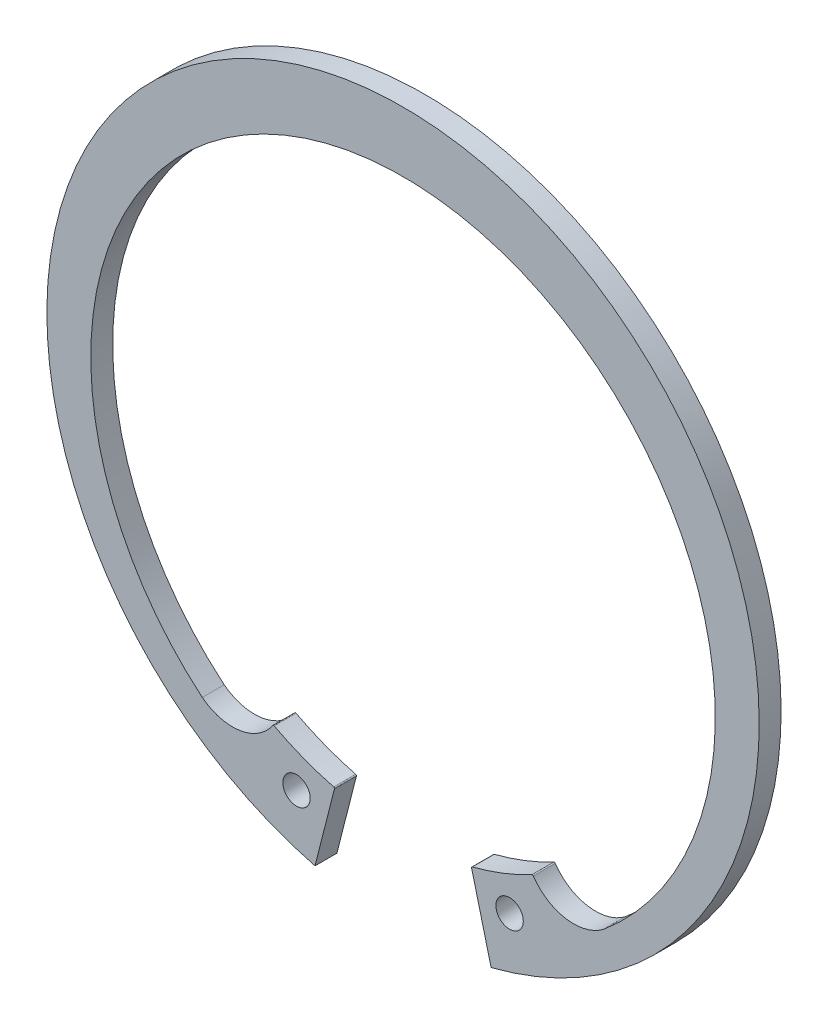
SolidWorks part; units mm, degrees
ref_plane "Plane1" through (0, 0, 0) normal (0, 0, 1) x (1, 0, 0)
ref_plane "Plane2" through (0, 0, 0) normal (0, 1, 0) x (1, 0, 0)
ref_plane "Plane3" through (0, 0, 0) normal (1, 0, 0) x (0, 0, -1)
sketch "Clipboard" plane through (0, 0, 0) normal (0, 0, 1) x (1, 0, 0)
  line L0 (0, 0) -> (5.5, 0)
  line L1 (0, 0) -> (0, 2.75)
  line L2 (0, 0) -> (0, -7.3)
  circle A0 centre (0, 0) radius 1.25
  circle A1 centre (0, 0) radius 31
  dimension "HoleDia" = 2.5
  dimension "BoreDia" = 62
  dimension "LargeSection" = 5.5
  dimension "SmallSection" = 2.75
  dimension "LugSection" = 7.3
sketch "BodySke" plane through (0, 0, 0) normal (0, 0, 1) x (1, 0, 0)
  line L0 (-1.5431, 0) -> (1.5431, 0) construction
  line L1 (0, 0) -> (0, 27) construction
  line L2 (8.0368, -31.4906) -> (6.9116, -27.0819)
  line L3 (-8.0368, -31.4906) -> (-6.9116, -27.0819)
  line L4 (0, 0) -> (17.2586, -27.5389) construction
  line L5 (0, 0) -> (-17.2586, -27.5389) construction
  line L6 (-9.4124, -25.1536) -> (-10.0307, -27.576) construction
  line L7 (9.5359, -25.6375) -> (9.9072, -27.0921) construction
  arc A0 (-6.9116, -27.0819) -> (-11.9896, -24.5575) centre (-9.7215, -26.3648) ccw
  arc A1 (11.9896, -24.5575) -> (6.9116, -27.0819) centre (9.7215, -26.3648) ccw
  arc A2 (15.7982, -25.2087) -> (-15.7982, -25.2087) centre (0, -1.4946) ccw construction
  arc A3 (8.0368, -31.4906) -> (-8.0368, -31.4906) centre (0, 0) ccw
  circle A4 centre (9.7215, -26.3648) radius 1.25
  circle A5 centre (-9.7215, -26.3648) radius 1.25
  circle A6 centre (9.7215, -26.3648) radius 2.9 construction
  arc A7 (15.873, -25.1587) -> (-15.873, -25.1587) centre (0, -1.4946) ccw
  arc A8 (-9.7215, -26.3648) -> (9.7215, -26.3648) centre (0, 0) ccw construction
  arc A9 (-15.873, -25.1587) -> (-11.9896, -24.5575) centre (-14.2576, -22.7503) ccw
  arc A10 (11.9896, -24.5575) -> (15.873, -25.1587) centre (14.2576, -22.7503) ccw
  dimension "GrooveDia" = 65
  dimension "TipRad" = 2.9
  dimension "HoleOffsetRad" = 28.1
  dimension "HoleDia" = 2.5
  dimension "FilletRad" = 2.9
  dimension "LargeRad" = 27
  dimension "SmallRad" = 29.75
  dimension "SmallAngle" = 64.151
  dimension "GapAngle" = 28.634
extrude "Body" add sketch "BodySke" against normal blind 2
sketch "ModLugSke" plane through (0, 0, 0) normal (0, 0, 1) x (1, 0, 0)
  line L0 (8.0368, -31.4906) -> (6.2563, -24.5141)
  line L1 (-8.0368, -31.4906) -> (-6.2563, -24.5141)
  line L2 (15.5667, -19.8171) -> (20.0761, -25.5578) construction
  line L3 (-15.5667, -19.8171) -> (-20.0761, -25.5578) construction
  line L4 (-8.0368, -31.4906) -> (-6.9116, -27.0819) construction
  line L5 (6.9116, -27.0819) -> (8.0368, -31.4906) construction
  line L6 (0, 0) -> (0, -18.0732) construction
  line L7 (18.317, -23.3183) -> (20.0761, -25.5578)
  line L8 (-20.0761, -25.5578) -> (-18.317, -23.3183)
  arc A0 (8.0368, -31.4906) -> (20.0761, -25.5578) centre (0, 0) ccw
  arc A1 (-11.7565, -22.2896) -> (-6.3281, -24.3925) centre (0, 0) ccw
  arc A2 (8.0368, -31.4906) -> (-8.0368, -31.4906) centre (0, 0) ccw construction
  arc A3 (11.9896, -24.5575) -> (6.9116, -27.0819) centre (9.7215, -26.3648) ccw construction
  arc A4 (-11.7565, -22.2896) -> (-11.8858, -22.3218) centre (-11.8031, -22.378) ccw
  arc A5 (-18.317, -23.3183) -> (-11.8858, -22.3218) centre (-15.5667, -19.8171) ccw
  arc A6 (15.873, -25.1587) -> (-15.873, -25.1587) centre (0, -1.4946) ccw construction
  arc A7 (11.8858, -22.3218) -> (18.317, -23.3183) centre (15.5667, -19.8171) ccw
  arc A8 (6.3281, -24.3925) -> (11.7565, -22.2896) centre (0, 0) ccw
  arc A9 (-20.0761, -25.5578) -> (-8.0368, -31.4906) centre (0, 0) ccw
  circle A10 centre (-9.7215, -26.3648) radius 1.25
  circle A11 centre (-9.7215, -26.3648) radius 1.25 construction
  circle A12 centre (9.7215, -26.3648) radius 1.25
  circle A13 centre (9.7215, -26.3648) radius 1.25 construction
  arc A14 (-6.3281, -24.3925) -> (-6.2563, -24.5141) centre (-6.3532, -24.4893) cw
  arc A15 (6.3281, -24.3925) -> (6.2563, -24.5141) centre (6.3532, -24.4893) ccw
  arc A16 (11.7565, -22.2896) -> (11.8858, -22.3218) centre (11.8031, -22.378) cw
  point P43 (6.2316, -24.4174)
  dimension "D1" = 0.1
  dimension "LugAng" = 55.618
extrude "ModLug" add sketch "ModLugSke" against normal through all
sketch "UnlSke" [suppressed] plane through (0, 0, 0) normal (0, 0, 1) x (1, 0, 0)
  line L0 (2.1178, -8.3352) -> (3.2259, -12.6966)
  line L1 (-2.1178, -8.3352) -> (-3.2259, -12.6966)
  line L2 (-3.2259, -12.6966) -> (-2.1422, -8.4315) construction
  line L3 (2.1422, -8.4315) -> (3.2259, -12.6966) construction
  arc A0 (2.1178, -8.3352) -> (-2.1178, -8.3352) centre (0, 0) ccw
  arc A1 (3.2259, -12.6966) -> (-3.2259, -12.6966) centre (0, 0) ccw
  arc A2 (3.2259, -12.6966) -> (-3.2259, -12.6966) centre (0, 0) ccw construction
  circle A4 centre (-4.4431, -9.5688) radius 1
  circle A5 centre (4.4431, -9.5688) radius 1
  circle A6 centre (4.4431, -9.5688) radius 1 construction
  circle A7 centre (-4.4431, -9.5688) radius 1 construction
  arc A8 (2.2134, -8.3103) -> (4.9183, -7.0548) centre (0, 0) ccw construction
extrude "Unlug" [suppressed] add sketch "UnlSke" against normal through all
equation "' \"BoreDia@Clipboard\" = 8"
equation "' \"Thickness@Body\" = 0.8"
equation "' \"GrooveDia@BodySke\" = 8.4"
equation "' \"LugSection@Clipboard\" = 2.4"
equation "' \"LargeSection@Clipboard\" = 1.1"
equation "' \"HoleDia@Clipboard\" = 1.0"
equation "' \"BoreDia@Clipboard\" = 25"
equation "' \"Thickness@Body\" = 1.2"
equation "' \"GrooveDia@BodySke\" = 26.2"
equation "' \"LugSection@Clipboard\" = 4.5"
equation "' \"LargeSection@Clipboard\" = 2.7"
equation "' \"HoleDia@Clipboard\" = 2"
equation "\"SmallSection@Clipboard\" = \"LargeSection@Clipboard\" * 0.5"
equation "\"TipRad@BodySke\" = (\"LugSection@Clipboard\" - (\"GrooveDia@BodySke\" / 2  -  \"BoreDia@Clipboard\" / 2 ) ) / 2"
equation "\"HoleOffsetRad@BodySke\" = (\"GrooveDia@BodySke\" / 2) - \"LugSection@Clipboard\"  + \"TipRad@BodySke\""
equation "\"LargeRad@BodySke\" =  \"GrooveDia@BodySke\" / 2 -  \"LargeSection@Clipboard\""
equation "\"SmallRad@BodySke\" =  \"GrooveDia@BodySke\" / 2 -  \"SmallSection@Clipboard\""
equation "\"HoleDia@BodySke\" =  \"HoleDia@Clipboard\""
equation "\"FilletRad@BodySke\" = \"TipRad@BodySke\" * 1.0"
equation "\"GapAngle@BodySke\" = 360 - 0.965 * 360 * ( \"BoreDia@Clipboard\" /  \"GrooveDia@BodySke\")"
equation "\"LugAng@ModLugSke\" = \"GapAngle@BodySke\"  + 2 * 360 * (\"LugSection@Clipboard\" / (\"BoreDia@Clipboard\" * 3.1416))"
